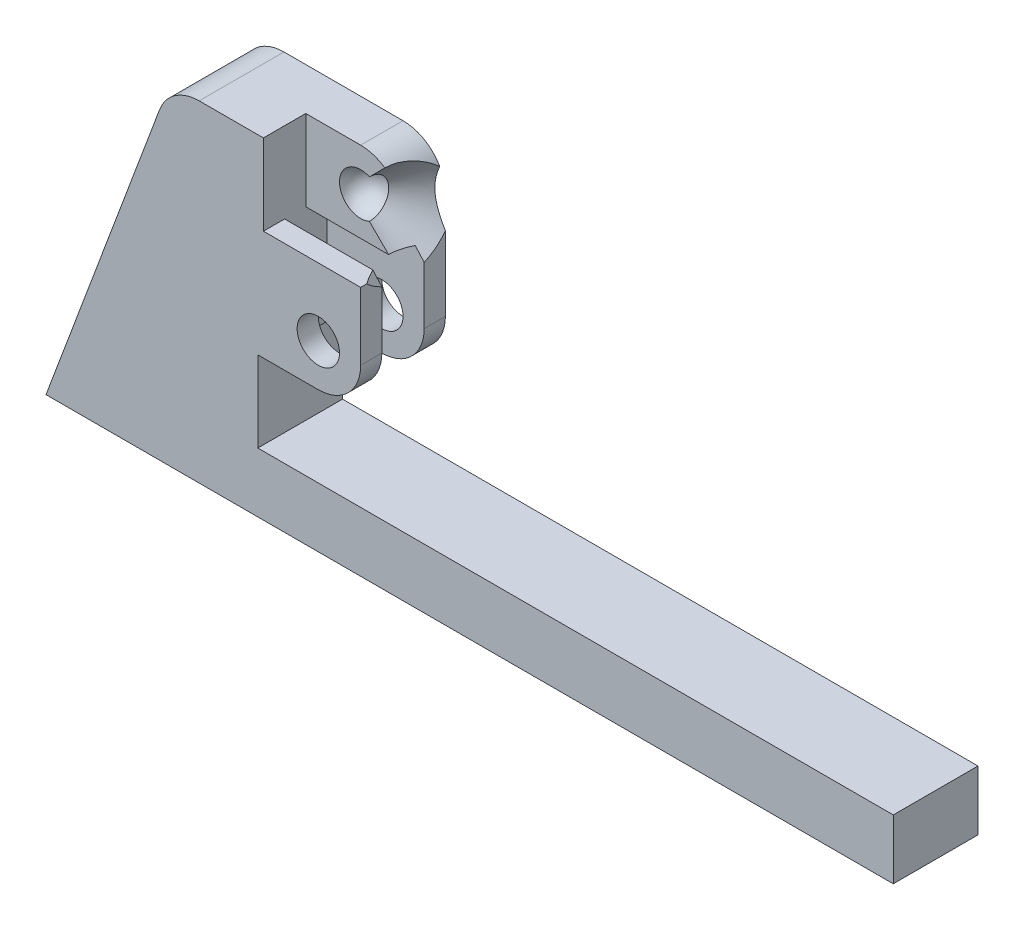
SolidWorks part; units mm, degrees
ref_plane "Plan1" through (0, 0, 0) normal (0, 0, 1) x (1, 0, 0)
ref_plane "Plan2" through (0, 0, 0) normal (0, 1, 0) x (1, 0, 0)
ref_plane "Plan3" through (0, 0, 0) normal (1, 0, 0) x (0, 0, -1)
sketch "Esquisse1" plane through (0, 0, 0) normal (0, 0, 1) x (1, 0, 0)
  line L0 (0, 35) -> (-28.1082, 35)
  line L1 (-37.4743, 28.5037) -> (-64.2769, -43.1448)
  line L2 (-64.2769, -43.1448) -> (135.7231, -43.1448)
  line L3 (135.7231, -43.1448) -> (135.7231, -29.0567)
  line L4 (135.7231, -29.0567) -> (-14.2769, -29.0567)
  line L5 (-14.2769, -29.0567) -> (-14.2769, -10)
  line L6 (0, -10) -> (-14.2769, -10)
  line L7 (10, 25) -> (10, 0)
  circle A0 centre (0, 0) radius 5
  arc A1 (0, -10) -> (10, 0) centre (0, 0) ccw
  arc A2 (10, 25) -> (0, 35) centre (0, 25) ccw
  arc A3 (-37.4743, 28.5037) -> (-28.1082, 35) centre (-28.1082, 25) cw
  dimension "D1" = 10
  dimension "D2" = 20
  dimension "D3" = 20
  dimension "D4" = 25
  dimension "D5" = 10
  dimension "D6" = 200
  dimension "D7" = 150
extrude "Base-Extrusion" add sketch "Esquisse1" along normal mid plane 20
sketch "Esquisse2" plane through (0, 0, 0) normal (0, 0, 1) x (1, 0, 0)
  line L0 (-16.0329, 25) -> (34.5935, 25) construction
  line L1 (2.0683, 29.5522) -> (11.553, 39.0515)
  line L2 (11.553, 39.0515) -> (11.553, 25)
  line L3 (11.553, 25) -> (-5, 25)
  arc A0 (2.0683, 29.5522) -> (-5, 25) centre (0, 25) ccw
  dimension "D2" = 10
  dimension "D1" = 25
revolve "Enlèvement de matière-Révolution1" cut sketch "Esquisse2" angle 360 about L0
sketch "Esquisse3" plane through (0, 0, 10) normal (0, 0, 1) x (1, 0, 0)
  line L1 (-12.9562, 15.9264) -> (19.4895, 15.9264)
  line L2 (-12.9562, 15.9264) -> (-12.9562, 46.4142)
  line L3 (-12.9562, 46.4142) -> (19.4895, 46.4142)
  line L4 (19.4895, 15.9264) -> (19.4895, 46.4142)
extrude "Enlèv. mat.-Extru.1" cut sketch "Esquisse3" against normal blind 10
sketch "Esquisse4" plane through (0, 15.9264, 0) normal (0, 1, 0) x (-1, 0, 0)
  line L0 (12.9562, 10) -> (12.9562, 0) construction
  line L1 (-14.7625, -5) -> (12.9562, -5)
  line L2 (-14.7625, -5) -> (-14.7625, 5)
  line L3 (-14.7625, 5) -> (12.9562, 5)
  line L4 (12.9562, -5) -> (12.9562, 5)
  line L5 (-135.7231, 10) -> (14.2769, 10) construction
  dimension "D1" = 10
  dimension "D2" = 5
extrude "Enlèv. mat.-Extru.2" cut sketch "Esquisse4" against normal up to surface (44.9831 mm away)
